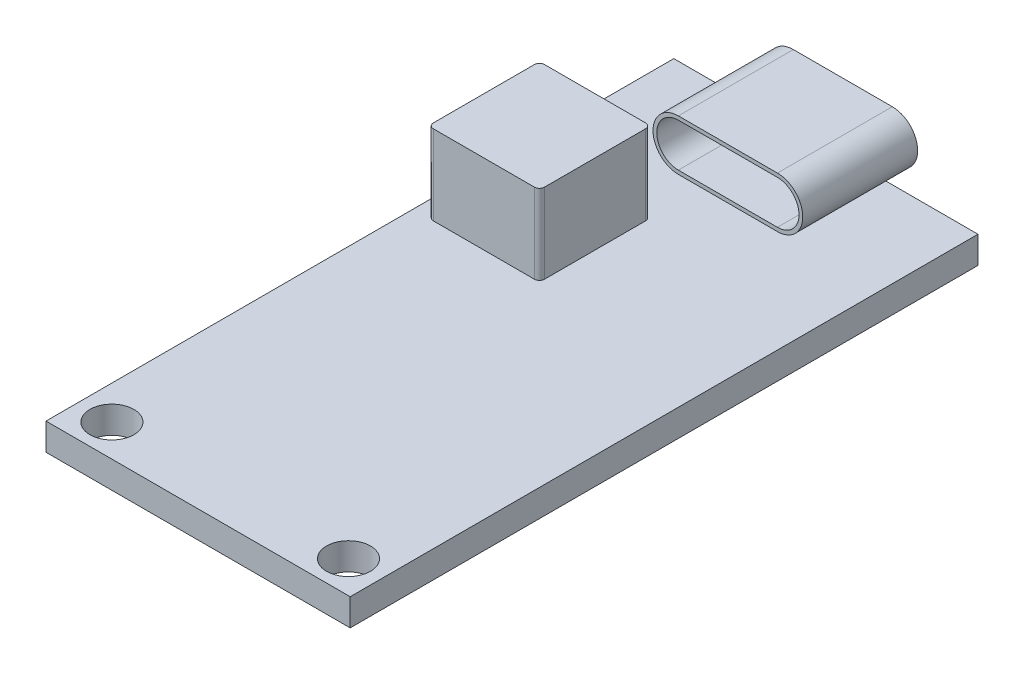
SolidWorks part; units mm, degrees
ref_plane "Front Plane" through (0, 0, 0) normal (0, 0, 1) x (1, 0, 0)
ref_plane "Top Plane" through (0, 0, 0) normal (0, 1, 0) x (1, 0, 0)
ref_plane "Right Plane" through (0, 0, 0) normal (1, 0, 0) x (0, 0, -1)
sketch "Sketch1" plane through (0, 0, 0) normal (0, 1, 0) x (1, 0, 0)
  line L1 (9, -18.575) -> (-9, -18.575)
  line L2 (9, -18.575) -> (9, 18.575)
  line L3 (9, 18.575) -> (-9, 18.575)
  line L4 (-9, -18.575) -> (-9, 18.575)
  line L5 (9, -18.575) -> (-9, 18.575) construction
  line L6 (9, 18.575) -> (-9, -18.575) construction
  point P0 (0, 0)
  dimension "D1" = 18
  dimension "D2" = 37.15
extrude "Boss-Extrude1" add sketch "Sketch1" along normal blind 1.6
sketch "Sketch2" plane through (0, 1.6, 0) normal (0, 1, 0) x (1, 0, 0)
  line L0 (-7, -16.675) -> (7, -16.675) construction
  line L2 (-9, -18.575) -> (9, -18.575) construction
  circle A0 centre (-7, -16.675) radius 1.3
  circle A1 centre (7, -16.675) radius 1.3
  point P4 (0, -16.675)
  point P8 (7, -17.975)
  dimension "D1" = 2.6
  dimension "D2" = 14
  dimension "D3" = 0.6
extrude "Cut-Extrude1" cut sketch "Sketch2" against normal through all
sketch "Sketch3" plane through (0, 0, -18.575) normal (0, 0, -1) x (-1, 0, 0)
  line L0 (2.93, 3.1) -> (-2.93, 3.1) construction
  line L1 (2.93, 1.6) -> (-2.93, 1.6)
  line L2 (2.93, 4.6) -> (-2.93, 4.6)
  line L3 (-9, 1.6) -> (9, 1.6) construction
  line L5 (2.93, 1.82) -> (-2.93, 1.82)
  line L6 (2.93, 4.38) -> (-2.93, 4.38)
  arc A0 (2.93, 1.6) -> (2.93, 4.6) centre (2.93, 3.1) ccw
  arc A1 (-2.93, 4.6) -> (-2.93, 1.6) centre (-2.93, 3.1) ccw
  arc A2 (-2.93, 4.38) -> (-2.93, 1.82) centre (-2.93, 3.1) ccw
  arc A3 (2.93, 1.82) -> (2.93, 4.38) centre (2.93, 3.1) ccw
  point P2 (0, 3.1)
  point P9 (-4.43, 3.1)
  point P10 (4.43, 3.1)
  dimension "D1" = 8.86
  dimension "D2" = 3
  dimension "D3" = 0.22
extrude "Boss-Extrude2" add sketch "Sketch3" along normal blind 1 and the other way blind 5.8
sketch "Sketch4" plane through (0, 1.6, 0) normal (0, 1, 0) x (1, 0, 0)
  line L0 (-9, -18.575) -> (9, -18.575) construction
  line L1 (-8.1, 9.725) -> (-1.52, 9.725)
  line L2 (-8.1, 9.725) -> (-8.1, 3.145)
  line L3 (-8.1, 3.145) -> (-1.52, 3.145)
  line L4 (-1.52, 9.725) -> (-1.52, 3.145)
  line L5 (-8.1, 9.725) -> (-1.52, 3.145) construction
  line L6 (-8.1, 3.145) -> (-1.52, 9.725) construction
  line L7 (-9, 18.575) -> (-9, -18.575) construction
  point P0 (-4.81, 6.435)
  dimension "D1" = 6.58
  dimension "D2" = 28.3
  dimension "D3" = 0.9
extrude "Boss-Extrude3" add sketch "Sketch4" along normal blind 4.72
fillet "Fillet1" radius 0.3 4 edges at (-8.1, 3.96, -9.725) (-1.52, 3.96, -9.725) (-8.1, 3.96, -3.145) (-1.52, 3.96, -3.145)
